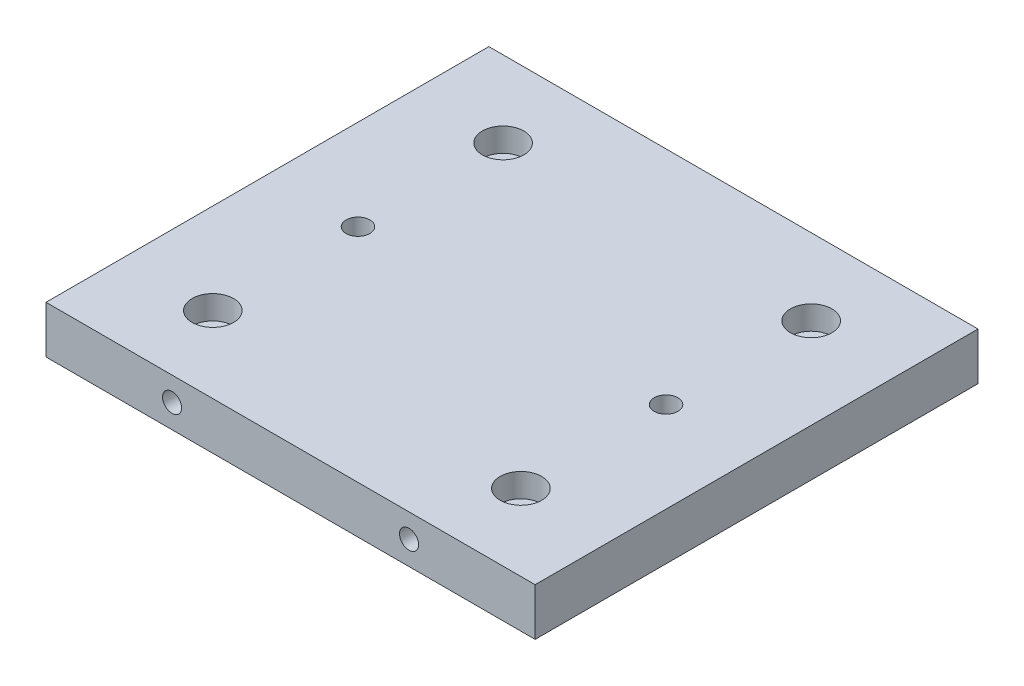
SolidWorks part; units mm, degrees
ref_plane "Front Plane" through (0, 0, 0) normal (0, 0, 1) x (1, 0, 0)
ref_plane "Top Plane" through (0, 0, 0) normal (0, 1, 0) x (1, 0, 0)
ref_plane "Right Plane" through (0, 0, 0) normal (1, 0, 0) x (0, 0, -1)
sketch "Sketch1" plane through (0, 0, 0) normal (0, 1, 0) x (1, 0, 0)
  line L1 (-65.532, 59.3344) -> (65.532, 59.3344)
  line L2 (-65.532, 59.3344) -> (-65.532, -59.3344)
  line L3 (-65.532, -59.3344) -> (65.532, -59.3344)
  line L4 (65.532, 59.3344) -> (65.532, -59.3344)
  line L5 (-65.532, 59.3344) -> (65.532, -59.3344) construction
  line L6 (-65.532, -59.3344) -> (65.532, 59.3344) construction
  point P0 (0, 0)
  dimension "D1" = 118.6688
  dimension "D2" = 131.064
extrude "Boss-Extrude1" add sketch "Sketch1" along normal blind 12.7
hole_wizard "CBORE for 1/4 Socket Head Cap Screw1" positions "Sketch2" profile "Sketch3" counterbore size "1/4" standard "ANSI Inch"
sketch "Sketch2" plane through (0, 12.7, 0) normal (0, 1, 0) x (1, 0, 0)
  point P0 (41.275, -38.8874)
  point P3 (41.275, 38.8874)
  point P6 (-41.275, -38.8874)
  point P9 (-41.275, 38.8874)
sketch "Sketch3" plane through (41.275, 12.7, 38.8874) normal (1, 0, 0) x (0, 0, 1)
  line L0 (0, 0) -> (0, 12.7)
  line L1 (0, 12.7) -> (3.3782, 12.7)
  line L3 (3.3782, 12.7) -> (3.3782, 6.35)
  line L4 (3.3782, 6.35) -> (5.5562, 6.35)
  line L5 (5.5562, 6.35) -> (5.5563, 0)
  line L7 (5.5563, 0) -> (0, 0)
  line L11 (0, -6.35) -> (0, 107.95) construction
  dimension "Thru Hole Dia." = 6.7564
  dimension "Thru Hole Depth" = 12.7
  dimension "C'Bore Dia." = 11.1125
  dimension "C'Bore Depth" = 6.35
hole_wizard "1/4 (0.2500) Dowel Hole1" positions "Sketch4" profile "Sketch5" hole size "1/4" standard "ANSI Inch"
sketch "Sketch4" plane through (0, 0, 0) normal (0, -1, 0) x (-1, 0, 0)
  point P0 (-41.275, 0)
  point P3 (41.275, 0)
sketch "Sketch5" plane through (41.275, 0, 0) normal (1, 0, 0) x (0, 0, -1)
  line L0 (0, 0) -> (0, 12.7)
  line L1 (0, 12.7) -> (3.175, 12.7)
  line L2 (3.175, 12.7) -> (3.175, 0)
  line L5 (3.175, 0) -> (0, 0)
  line L11 (0, -6.35) -> (0, 107.95) construction
  dimension "Thru Hole Dia." = 6.35
  dimension "Thru Hole Depth" = 12.7
hole_wizard "1/4-20 Tapped Hole1" positions "Sketch6" profile "Sketch7" tap size "1/4-20" standard "ANSI Inch"
sketch "Sketch6" plane through (0, 0, -59.3344) normal (0, 0, -1) x (-1, 0, 0)
  line L0 (0, 12.7) -> (0, 31.6083) construction
  line L1 (-65.532, 12.7) -> (65.532, 12.7) construction
  line L3 (65.532, 6.35) -> (31.75, 6.35) construction
  line L4 (65.532, 12.7) -> (65.532, 0) construction
  point P0 (31.75, 6.35)
  point P10 (-31.75, 6.35)
  dimension "D1" = 63.5
sketch "Sketch7" plane through (-31.75, 6.35, -59.3344) normal (1, 0, 0) x (0, 1, 0)
  line L0 (0, 0) -> (0, 18.0438)
  line L1 (0, 18.0438) -> (2.5527, 16.51)
  line L2 (2.5527, 16.51) -> (2.5527, 0)
  line L5 (2.5527, 0) -> (0, 0)
  line L10 (0, 18.0438) -> (-2.5527, 16.51) construction
  line L11 (0, -6.35) -> (0, 107.95) construction
  dimension "Tap Drill Dia." = 5.1054
  dimension "Tap Drill Depth" = 16.51
  dimension "Drill Angle" = 118
mirror "Mirror1" about plane through (0, 0, 0) normal (0, 0, 1) of "1/4-20 Tapped Hole1"
